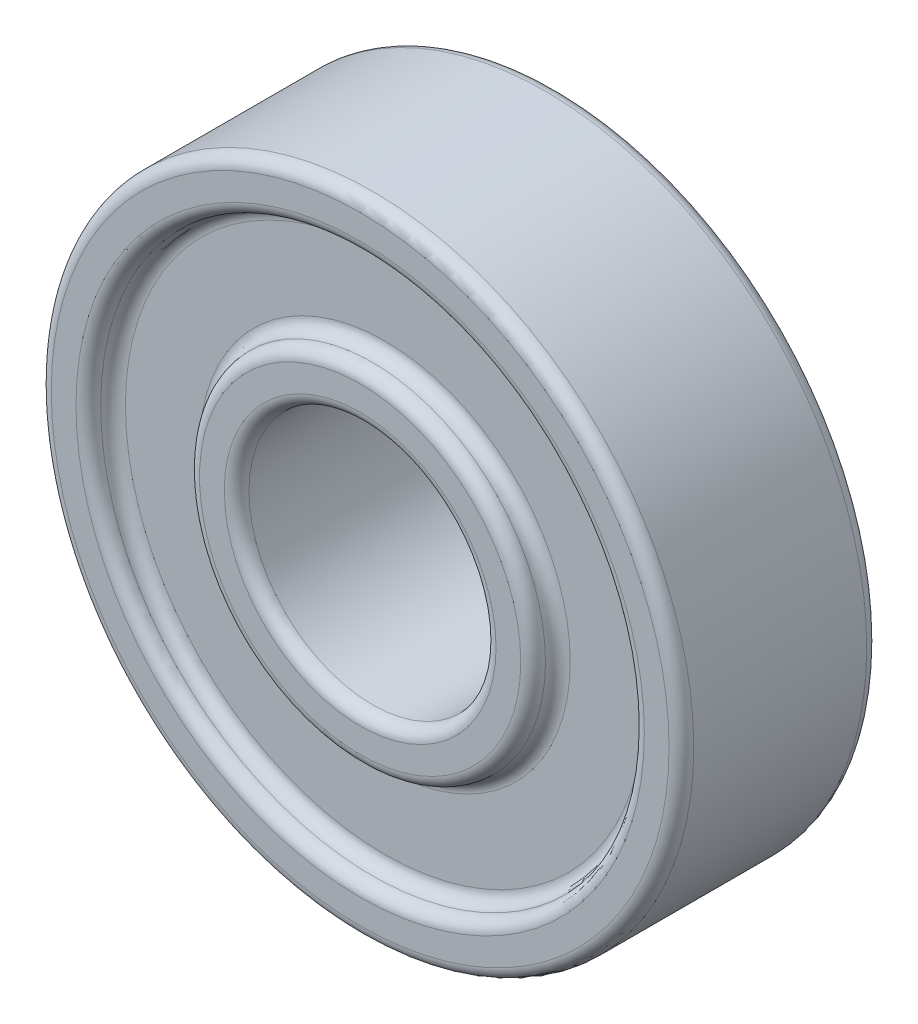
SolidWorks part; units mm, degrees
ref_plane "Plan1" through (0, 0, 0) normal (0, 0, 1) x (1, 0, 0)
ref_plane "Plan2" through (0, 0, 0) normal (0, 1, 0) x (1, 0, 0)
ref_plane "Plan3" through (0, 0, 0) normal (1, 0, 0) x (0, 0, -1)
sketch "Esquisse1" plane through (0, 0, 0) normal (0, 0, 1) x (1, 0, 0)
  circle A0 centre (0, 0) radius 5
  circle A1 centre (0, 0) radius 13
  dimension "D1" = 10
  dimension "D2" = 26
extrude "Base-Extrusion" add sketch "Esquisse1" along normal blind 8
sketch "Esquisse2" plane through (0, 0, 8) normal (0, 0, 1) x (1, 0, 0)
  circle A0 centre (0, 0) radius 7
  circle A1 centre (0, 0) radius 11
  dimension "D1" = 14
  dimension "D2" = 22
extrude "Enlèv. mat.-Extru.1" cut sketch "Esquisse2" against normal blind 1
sketch "Esquisse3" plane through (0, 0, 0) normal (0, 0, -1) x (-1, 0, 0)
  circle A0 centre (0, 0) radius 11
  circle A1 centre (0, 0) radius 7
  dimension "D1" = 22
  dimension "D2" = 14
extrude "Enlèv. mat.-Extru.2" cut sketch "Esquisse3" against normal blind 1
fillet "Congé2" radius 0.5
